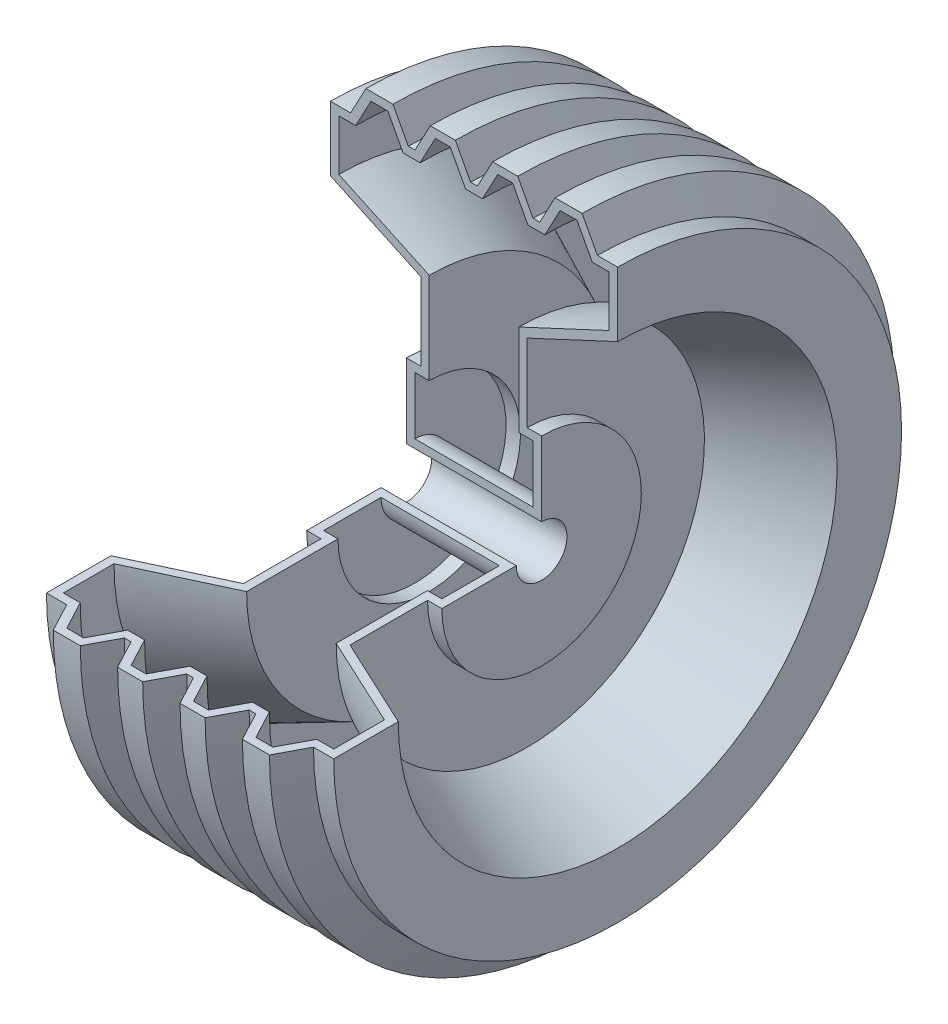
SolidWorks part; units mm, degrees
ref_plane "Front Plane" through (0, 0, 0) normal (0, 0, 1) x (1, 0, 0)
ref_plane "Top Plane" through (0, 0, 0) normal (0, 1, 0) x (1, 0, 0)
ref_plane "Right Plane" through (0, 0, 0) normal (1, 0, 0) x (0, 0, -1)
sketch "Sketch1" plane through (0, 0, 0) normal (0, 0, 1) x (1, 0, 0)
  line L0 (-56.6547, 0) -> (69.8986, 0) construction
  line L1 (0, 180) -> (0, -30.7186) construction
  line L2 (-35, 20) -> (35, 20)
  line L3 (35, 20) -> (35, 54)
  line L4 (-35, 20) -> (-35, 54)
  line L5 (35, 54) -> (26.5, 54)
  line L6 (-35, 54) -> (-26.5, 54)
  line L7 (26.5, 54) -> (26.5, 108.0525)
  line L8 (-26.5, 54) -> (-26.5, 108.0525)
  line L9 (26.5, 108.0525) -> (80, 133)
  line L10 (-26.5, 108.0525) -> (-80, 133)
  line L11 (80, 133) -> (80, 163)
  line L12 (-80, 133) -> (-80, 163)
  line L13 (80, 163) -> (70, 163)
  line L14 (-80, 163) -> (-70, 163)
  line L15 (70, 163) -> (60.9609, 180)
  line L16 (-70, 163) -> (-60.9609, 180)
  line L17 (60.9609, 180) -> (50.9609, 180)
  line L18 (-60.9609, 180) -> (-50.9609, 180)
  line L19 (50.9609, 180) -> (41.9219, 163)
  line L20 (-50.9609, 180) -> (-41.9219, 163)
  line L21 (41.9219, 163) -> (31.9219, 163)
  line L22 (-41.9219, 163) -> (-31.9219, 163)
  line L23 (31.9219, 163) -> (22.8828, 180)
  line L24 (-31.9219, 163) -> (-22.8828, 180)
  line L25 (22.8828, 180) -> (14.0391, 180)
  line L26 (-22.8828, 180) -> (-14.0391, 180)
  line L27 (14.0391, 180) -> (5, 163)
  line L28 (-14.0391, 180) -> (-5, 163)
  line L29 (5, 163) -> (-5, 163)
  point P8 (0, 20)
  point P34 (0, 163)
  dimension "D1" = 40
  dimension "D2" = 108
  dimension "D3" = 360
  dimension "D4" = 30
  dimension "D5" = 70
  dimension "D6" = 53
  dimension "D7" = 17
  dimension "D8" = 10
  dimension "D9" = 62
  dimension "D10" = 160
  dimension "D11" = 65
  dimension "D12" = 10
revolve "Revolve-Thin1" add sketch "Sketch1" angle 270 about L0
